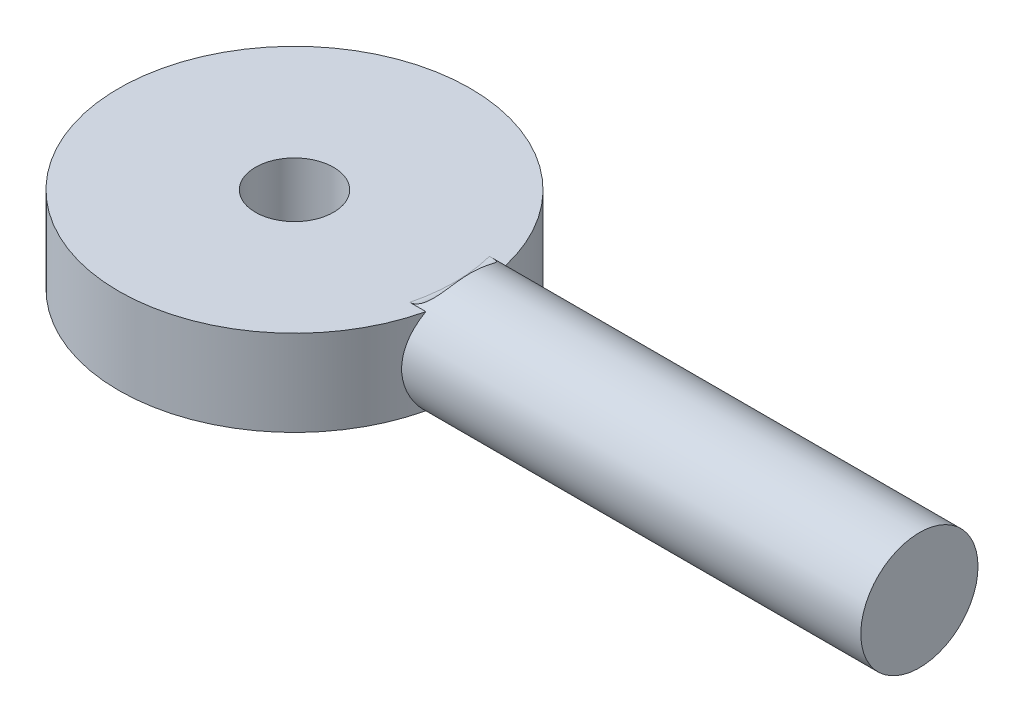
SolidWorks part; units mm, degrees
ref_plane "Front Plane" through (0, 0, 0) normal (0, 0, 1) x (1, 0, 0)
ref_plane "Top Plane" through (0, 0, 0) normal (0, 1, 0) x (1, 0, 0)
ref_plane "Right Plane" through (0, 0, 0) normal (1, 0, 0) x (0, 0, -1)
sketch "Sketch1" plane through (0, 0, 0) normal (0, 1, 0) x (1, 0, 0)
  circle A0 centre (0, 0) radius 14.2875
  dimension "D1" = 28.575
extrude "Boss-Extrude1" add sketch "Sketch1" along normal mid plane 6.985
hole_wizard "1/4 (0.25) Diameter Slot1" positions "Sketch4" profile "Sketch3" size "1/4" standard "ANSI Inch"
sketch "Sketch4" plane through (0, 3.4925, 0) normal (0, 1, 0) x (1, 0, 0)
  point P0 (0, 0)
sketch "Sketch3" plane through (0, 3.4925, 0) normal (1, 0, 0) x (0, 0, 1)
  line L0 (0, 0) -> (0, 6.985)
  line L1 (0, 6.985) -> (3.175, 6.985)
  line L2 (3.175, 6.985) -> (3.175, 0)
  line L5 (3.175, 0) -> (0, 0)
  line L11 (0, -6.35) -> (0, 107.95) construction
  dimension "Thru Hole Dia." = 6.35
  dimension "Thru Hole Depth" = 6.985
ref_plane "Plane1" through (50.8, 0, 0) normal (1, 0, 0) x (0, 0, -1)
sketch "Sketch5" plane through (50.8, 0, 0) normal (1, 0, 0) x (0, 0, -1)
  circle A0 centre (0, 0) radius 4.7625
  dimension "D1" = 9.525
extrude "Boss-Extrude2" add sketch "Sketch5" against normal up to surface (37.3296 mm away)
fillet "Fillet1" radius 1.27 2 edges at (14.2875, -3.4925, 0) (14.2875, 3.4925, 0)
